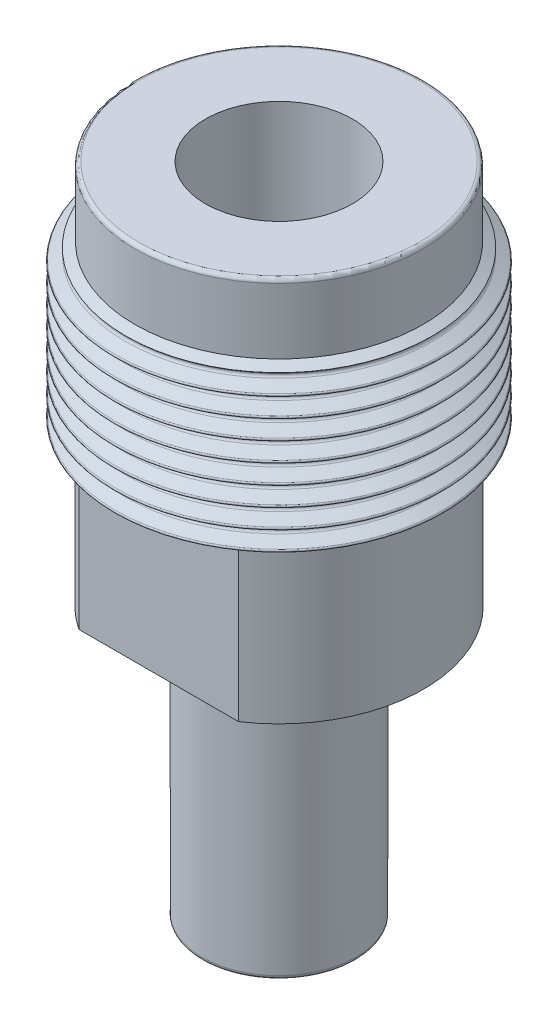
SolidWorks part; units mm, degrees
ref_plane "Front Plane" through (0, 0, 0) normal (0, 0, 1) x (1, 0, 0)
ref_plane "Top Plane" through (0, 0, 0) normal (0, 1, 0) x (1, 0, 0)
ref_plane "Right Plane" through (0, 0, 0) normal (1, 0, 0) x (0, 0, -1)
sketch "Sketch1" plane through (0, 0, 0) normal (0, 0, 1) x (1, 0, 0)
  line L0 (0, 0) -> (0, -5.092) construction
  line L1 (-2.4257, -3.81) -> (-1.905, -4.1229)
  line L2 (-2.4257, 0) -> (-5.4229, 0)
  line L3 (-2.4257, 0) -> (-2.4257, -3.81)
  line L4 (-4.7625, -7.62) -> (-5.4229, -7.62)
  line L5 (-5.4229, 0) -> (-5.4229, -7.62)
  line L6 (-1.905, -4.1229) -> (-1.905, -21.59)
  line L7 (-1.905, -21.59) -> (-2.54, -21.59)
  line L8 (-2.54, -21.59) -> (-2.54, -13.4874)
  line L9 (-3.3274, -12.7) -> (-4.7625, -12.7)
  line L10 (-4.7625, -12.7) -> (-4.7625, -7.62)
  arc A0 (-2.54, -13.4874) -> (-3.3274, -12.7) centre (-3.3274, -13.4874) ccw
  dimension "D11" = 0.7874
  dimension "D1" = 4.8514
  dimension "D2" = 10.8458
  dimension "D3" = 7.62
  dimension "D4" = 3.81
  dimension "D5" = 59
  dimension "D6" = 3.81
  dimension "D7" = 12.7
  dimension "D8" = 21.59
  dimension "D9" = 9.525
  dimension "D10" = 5.08
revolve "Revolve1" add sketch "Sketch1" angle 360 about L0
ref_axis "Axis1" through (0, -7.62, 0) along (0, 1, 0)
sketch "Sketch2" plane through (0, 0, 0) normal (0, 0, 1) x (1, 0, 0)
  line L0 (-5.4229, 0.3175) -> (-5.4229, -0.3175)
  line L1 (-5.4, 0.2778) -> (-5.0563, 0.0794)
  line L2 (-5.4229, 0) -> (-5.4229, -7.62) construction
  line L3 (-5.4, -0.2778) -> (-5.0563, -0.0794)
  line L4 (-5.0563, 0.0794) -> (-5.0563, -0.0794) construction
  line L6 (-5.0563, 0) -> (-3.0763, 0) construction
  line L7 (5.4229, 0) -> (-5.4229, 0) construction
  arc A0 (-5.0563, 0.0794) -> (-5.0563, -0.0794) centre (-5.1021, 0) cw
  arc A1 (-5.4, 0.2778) -> (-5.4229, 0.3175) centre (-5.3771, 0.3175) cw
  arc A2 (-5.4, -0.2778) -> (-5.4229, -0.3175) centre (-5.3771, -0.3175) ccw
  arc A3 (-5.4229, -0.3175) -> (-5.4, -0.3572) centre (-5.3771, -0.3175) ccw construction
  dimension "D4" = 0.0794
  dimension "D1" = 60
  dimension "D2" = 0.1588
  dimension "D3" = 0.635
revolve "Cut-Revolve1" cut sketch "Sketch2" angle 360 about axis through (0, -7.62, 0) along (0, 1, 0)
pattern_linear "LPattern1" count 13 spacing 0.635 along (0, -1, 0) of "Cut-Revolve1"
sketch "Sketch3" plane through (0, -7.62, 0) normal (0, -1, 0) x (1, 0, 0)
  line L0 (-3.4925, 0) -> (3.4925, 0) construction
  circle A0 centre (-3.4925, 0) radius 0.7938
  circle A1 centre (3.4925, 0) radius 0.7938
  dimension "D1" = 1.5875
  dimension "D2" = 6.985
extrude "Cut-Extrude1" [suppressed] cut sketch "Sketch3" against normal blind 3.81
sketch "Sketch4" plane through (0, -12.7, 0) normal (0, -1, 0) x (1, 0, 0)
  line L0 (-2.6326, 3.9688) -> (2.6326, 3.9688)
  line L1 (-2.6326, -3.9688) -> (2.6326, -3.9688)
  circle A0 centre (0, 0) radius 4.7625 construction
  arc A1 (-2.6326, -3.9688) -> (2.6326, -3.9688) centre (0, 0) ccw
  arc A2 (2.6326, 3.9688) -> (-2.6326, 3.9688) centre (0, 0) ccw
  dimension "D1" = 7.9375
extrude "Cut-Extrude2" cut sketch "Sketch4" against normal up to surface (5.08 mm away) and the other way blind 2.54
sketch "Sketch5" plane through (0, 0, 0) normal (0, 0, 1) x (1, 0, 0)
  line L0 (0, 0) -> (0, 1.3615) construction
  line L1 (0, -7.62) -> (0, 0) construction
  line L2 (5.0105, 0) -> (-5.0105, 0) construction
  line L4 (-4.7498, 0) -> (-6.4063, 0)
  line L5 (-4.7498, 0) -> (-4.7498, -2.286)
  line L6 (-4.7498, -2.286) -> (-6.4063, -3.2424)
  line L7 (-6.4063, 0) -> (-6.4063, -3.2424)
  dimension "D1" = 9.4996
  dimension "D2" = 60
  dimension "D3" = 2.286
revolve "Cut-Revolve2" cut sketch "Sketch5" angle 360 about L0
fillet "Fillet1" radius 0.127 3 edges at (0, 0, -4.7498) (0, -21.59, 2.54) (0, -21.59, 1.905)
equation "\"D4@Sketch2\"=\"D3@Sketch2\"*.125"
